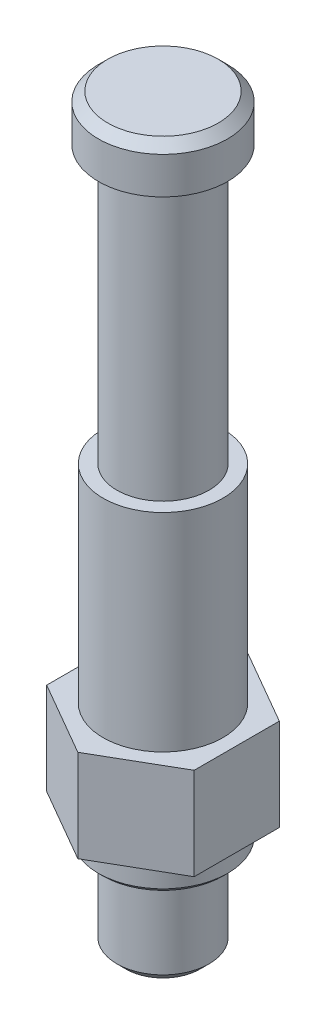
SolidWorks part; units mm, degrees
ref_plane "Plan de face" through (0, 0, 0) normal (0, 0, 1) x (1, 0, 0)
ref_plane "Plan de dessus" through (0, 0, 0) normal (0, 1, 0) x (1, 0, 0)
ref_plane "Plan de droite" through (0, 0, 0) normal (1, 0, 0) x (0, 0, -1)
sketch "Esquisse1" plane through (0, 0, 0) normal (0, 0, 1) x (1, 0, 0)
  line L0 (0, 0) -> (0, 23.7742) construction
  line L1 (0, 80.5) -> (-7, 80.5)
  line L2 (-7, 80.5) -> (-7, 75.5)
  line L3 (-7, 75.5) -> (-5, 75.5)
  line L4 (-5, 75.5) -> (-5, 45.5)
  line L5 (-5, 45.5) -> (-6.5, 45.5)
  line L6 (-6.5, 45.5) -> (-6.5, 23)
  line L7 (-6.5, 23) -> (-10, 23)
  line L8 (-10, 23) -> (-10, 13)
  line L9 (-10, 13) -> (-7, 13)
  line L10 (-5, 10) -> (-5, 0)
  line L11 (-5, 0) -> (0, 0)
  line L12 (-7, 13) -> (-7, 10)
  line L13 (-7, 10) -> (-5, 10)
  line L14 (0, 0) -> (0, 80.5)
  dimension "D1" = 14
  dimension "D2" = 5
  dimension "D3" = 80.5
  dimension "D4" = 10
  dimension "D5" = 35
  dimension "D6" = 13
  dimension "D7" = 20
  dimension "D8" = 10
  dimension "D9" = 10
  dimension "D10" = 14
  dimension "D11" = 3
  dimension "D12" = 10
revolve "Révolution2" add sketch "Esquisse1" angle 360 about L14
chamfer "Chanfrein1" distance 1 angle 45 2 edges at (0, 0, -5) (0, 80.5, -7)
chamfer "Chanfrein2" distance 0.5 angle 45 1 edges at (0, 10, -7)
sketch "Esquisse3" plane through (0, 0, 0) normal (0, 0, 1) x (1, 0, 0)
  line L1 (-17.4944, 33.9017) -> (-8, 33.9017)
  line L2 (-17.4944, 33.9017) -> (-17.4944, 11.3489)
  line L3 (-17.4944, 11.3489) -> (-8, 11.3489)
  line L4 (-8, 33.9017) -> (-8, 11.3489)
  dimension "D1" = 8
extrude "Enlèv. mat.-Extru.1" cut sketch "Esquisse3" against normal through all and the other way through all
pattern_circular "Répétition circulaire1" count 6 every 60 about axis through (0, 0, 0) along (0, 1, 0) of "Enlèv. mat.-Extru.1"
